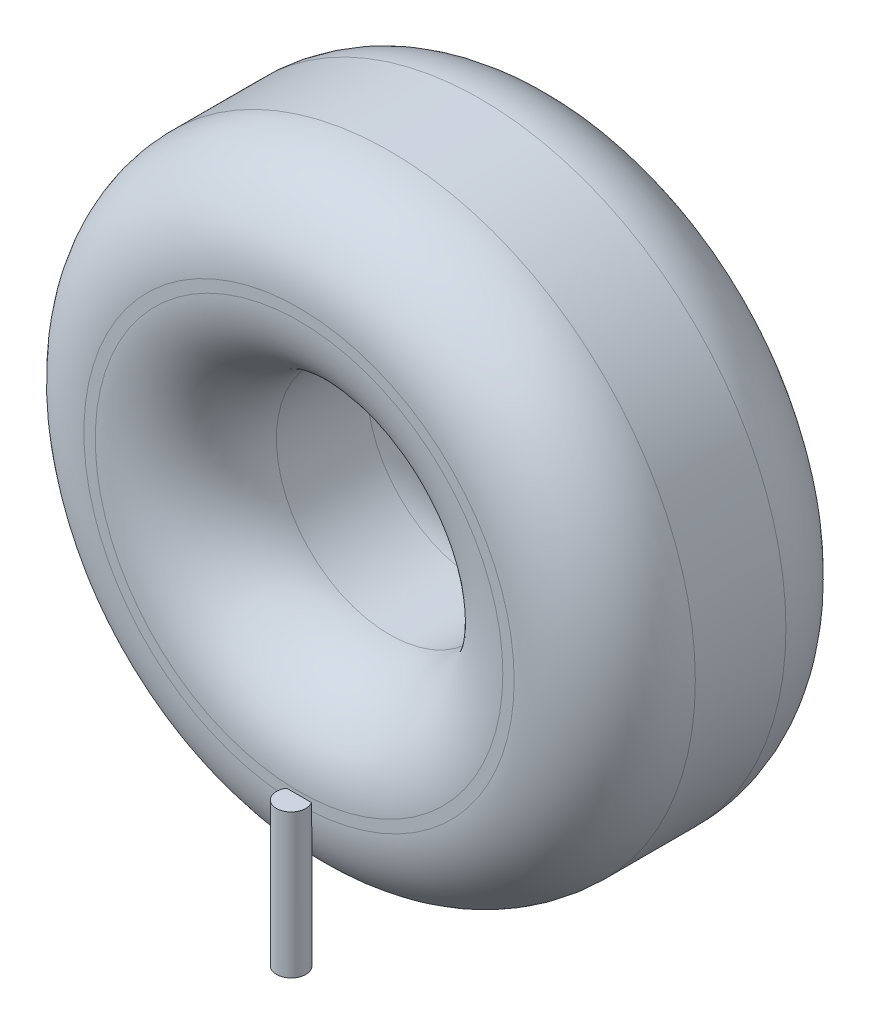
SolidWorks part; units mm, degrees
ref_plane "Front Plane" through (0, 0, 0) normal (0, 0, 1) x (1, 0, 0)
ref_plane "Top Plane" through (0, 0, 0) normal (0, 1, 0) x (1, 0, 0)
ref_plane "Right Plane" through (0, 0, 0) normal (1, 0, 0) x (0, 0, -1)
sketch "Sketch1" plane through (0, 0, 0) normal (0, 0, 1) x (1, 0, 0)
  circle A0 centre (0, 0) radius 13.5
  circle A1 centre (0, 0) radius 5
  dimension "D1" = 27
  dimension "D2" = 10
extrude "Boss-Extrude1" add sketch "Sketch1" along normal mid plane 12
fillet "Fillet1" radius 4 4 edges at (13.5, 0, -6) (13.5, 0, 6) (5, 0, -6) (5, 0, 6)
ref_plane "Plane1" through (0, -9.144, 0) normal (0, 1, 0) x (-1, 0, 0)
sketch "Sketch2" plane through (0, -9.144, 0) normal (0, 1, 0) x (-1, 0, 0)
  line L0 (0, 0) -> (-4.2629, 0) construction
  circle A0 centre (0, 6.35) radius 0.65
  circle A1 centre (0, -6.35) radius 0.65
  dimension "D1" = 1.3
  dimension "D2" = 12.7
extrude "Boss-Extrude2" add sketch "Sketch2" against normal blind 6.35
